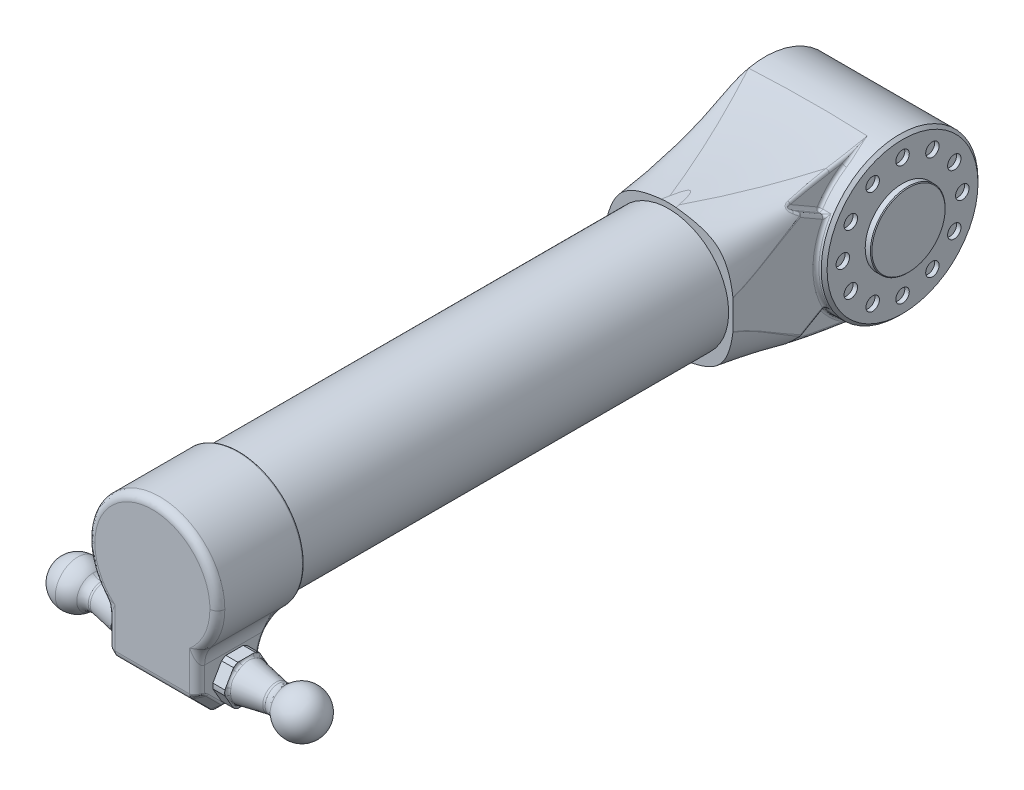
SolidWorks part; units mm, degrees
ref_plane "前视基准面" through (0, 0, 0) normal (0, 0, 1) x (1, 0, 0)
ref_plane "上视基准面" through (0, 0, 0) normal (0, 1, 0) x (1, 0, 0)
ref_plane "右视基准面" through (0, 0, 0) normal (1, 0, 0) x (0, 0, -1)
imported_body "输入1"
imported_body "输入2"
imported_body "输入3"
imported_body "输入4"
imported_body "输入5"
imported_body "输入6"
imported_body "输入7"
ref_plane "基准面1" through (0, -54, 0) normal (0, 1, 0) x (-1, 0, 0)
sketch "草图3" plane through (0, -54, 0) normal (0, 1, 0) x (-1, 0, 0)
  line L0 (80, 372.5) -> (51.1241, 372.5) construction
  line L2 (87.6528, 372.5) -> (90, 372.5)
  line L3 (75, 387.5) -> (75, 385.1528)
  arc A0 (90, 372.5) -> (75, 387.5) centre (75, 372.5) ccw
  arc A1 (87.6528, 372.5) -> (75, 385.1528) centre (75, 372.5) ccw
revolve "切除-旋转2" cut sketch "草图3" angle 360
sketch "草图1" plane through (0, -54, 0) normal (0, 1, 0) x (-1, 0, 0)
  line L0 (52.945, 372.5) -> (108.6183, 372.5) construction
  line L1 (39.4156, 372.5) -> (57.7273, 372.5) construction
  line L2 (60, 372.5) -> (90, 372.5)
  line L3 (0, 340.5) -> (0, 392.5) construction
  arc A0 (90, 372.5) -> (60, 372.5) centre (75, 372.5) ccw
  dimension "D1" = 15
  dimension "D2" = 75
revolve "旋转3" add sketch "草图1" angle 360 about L0
sketch "草图2" plane through (0, -54, 0) normal (0, 1, 0) x (-1, 0, 0)
  line L0 (-60.9066, 372.5) -> (-103.6072, 372.5) construction
  line L1 (-80, 372.5) -> (-51.1241, 372.5) construction
  line L2 (-90, 372.5) -> (-60, 372.5)
  arc A0 (-60, 372.5) -> (-90, 372.5) centre (-75, 372.5) ccw
  arc A1 (-90, 372.5) -> (-64.7052, 361.5905) centre (-75, 372.5) ccw construction
revolve "旋转4" add sketch "草图2" angle 360 about L0
